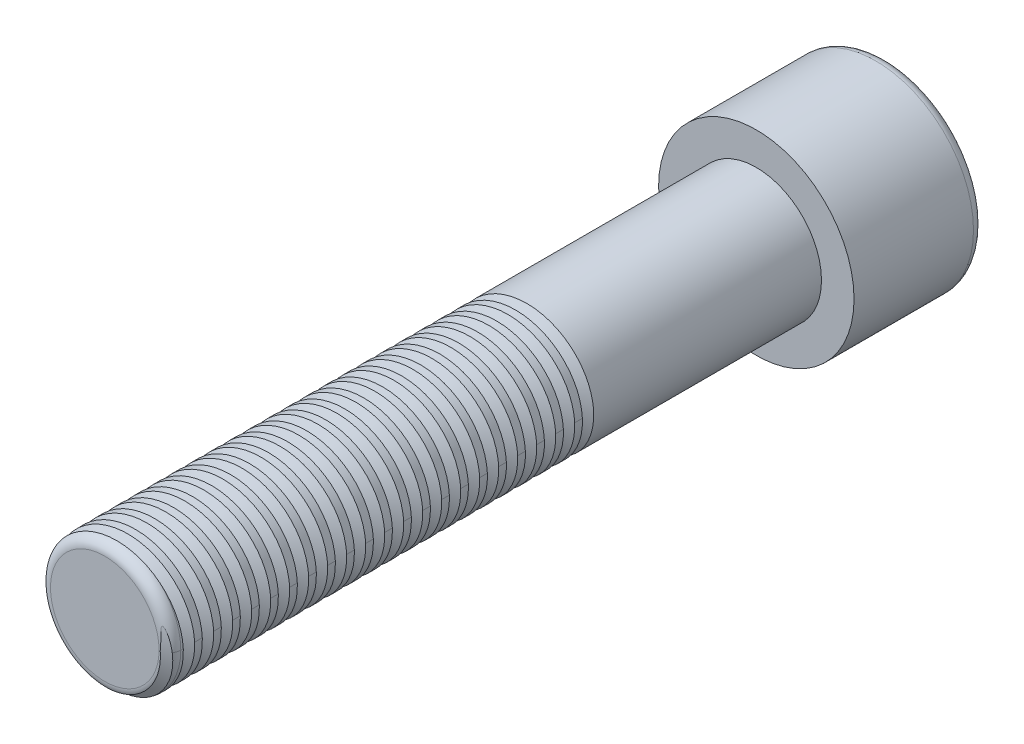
SolidWorks part; units mm, degrees
ref_plane "前视基准面" through (0, 0, 0) normal (0, 0, 1) x (1, 0, 0)
ref_plane "上视基准面" through (0, 0, 0) normal (0, 1, 0) x (1, 0, 0)
ref_plane "右视基准面" through (0, 0, 0) normal (1, 0, 0) x (0, 0, -1)
sketch "草图1" plane through (0, 0, 0) normal (0, 0, 1) x (1, 0, 0)
  circle A0 centre (0, 0) radius 9
extrude "凸台-拉伸1" add sketch "草图1" along normal blind 12
sketch "草图2" plane through (0, 0, 12) normal (0, 0, 1) x (1, 0, 0)
  circle A0 centre (0, 0) radius 6
extrude "凸台-拉伸2" add sketch "草图2" along normal blind 60 contours A0
fillet "圆角1" radius 1 2 edges at (9, 0, 0) (6, 0, 72)
sketch "草图3" plane through (0, 0, 72) normal (0, 0, 1) x (1, 0, 0)
  circle A0 centre (0, 0) radius 5.1
curve "螺旋线/涡状线1"
sketch "草图4" plane through (0, 0, 0) normal (0, 1, 0) x (1, 0, 0)
  line L0 (5.0999, -69.1546) -> (5.0999, -73.8346) construction
  line L2 (5.0999, -71.995) -> (6.4532, -72.7863)
  line L3 (6.4532, -72.7863) -> (6.4619, -71.2187)
  line L4 (6.4619, -71.2187) -> (5.0999, -71.995)
  circle A0 centre (6.005, -72) radius 0.4526 construction
  spline S0 degree 3 number of poles 368 (-3.6062, -72) -> (0.571, -32) construction
sweep "切除-扫描1" cut profiles "草图4" path "螺旋线/涡状线1"
sketch "草图5" plane through (0, 0, 0) normal (0, 0, -1) x (-1, 0, 0)
  line L1 (3.2716, -4.7571) -> (5.7556, 0.4548)
  line L2 (5.7556, 0.4548) -> (2.4839, 5.2119)
  line L3 (2.4839, 5.2119) -> (-3.2716, 4.7571)
  line L4 (-3.2716, 4.7571) -> (-5.7556, -0.4548)
  line L5 (-5.7556, -0.4548) -> (-2.4839, -5.2119)
  line L6 (-2.4839, -5.2119) -> (3.2716, -4.7571)
  circle A0 centre (0, 0) radius 5 construction
  dimension "D1" = 10
extrude "切除-拉伸1" cut sketch "草图5" against normal blind 6
